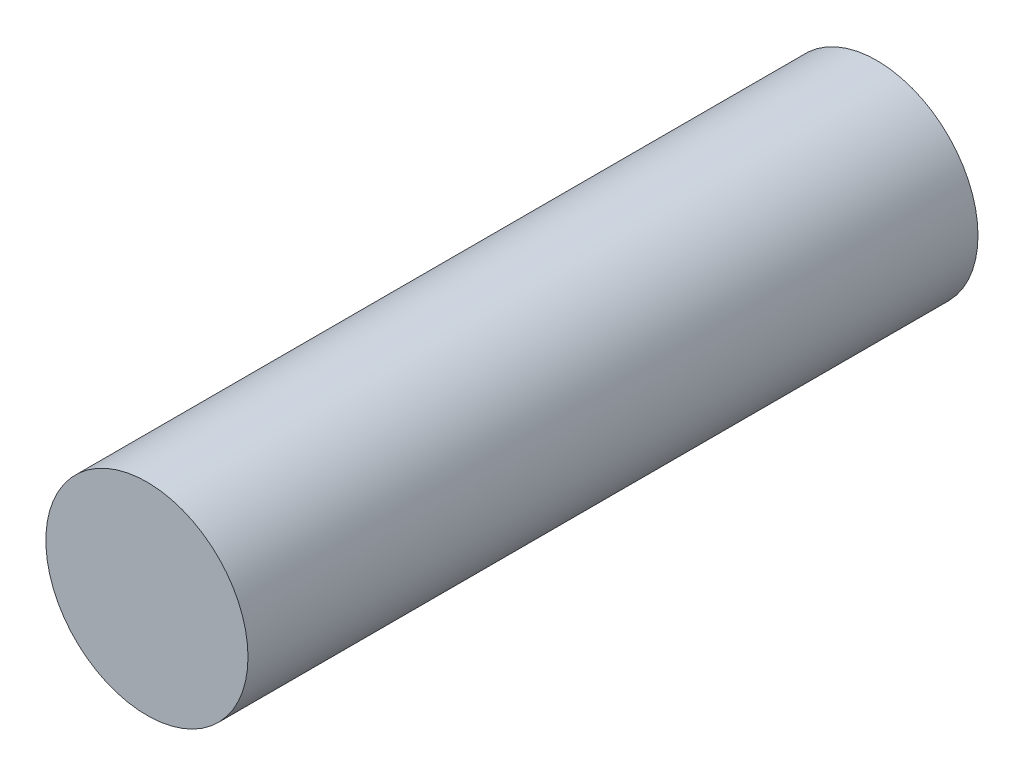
SolidWorks part; units mm, degrees
ref_plane "Front Plane" through (0, 0, 0) normal (0, 0, 1) x (1, 0, 0)
ref_plane "Top Plane" through (0, 0, 0) normal (0, 1, 0) x (1, 0, 0)
ref_plane "Right Plane" through (0, 0, 0) normal (1, 0, 0) x (0, 0, -1)
sketch "Sketch1" plane through (0, 0, 0) normal (0, 0, 1) x (1, 0, 0)
  circle A0 centre (0, 0) radius 9
  dimension "D1" = 18
extrude "Boss-Extrude1" add sketch "Sketch1" against normal blind 65
